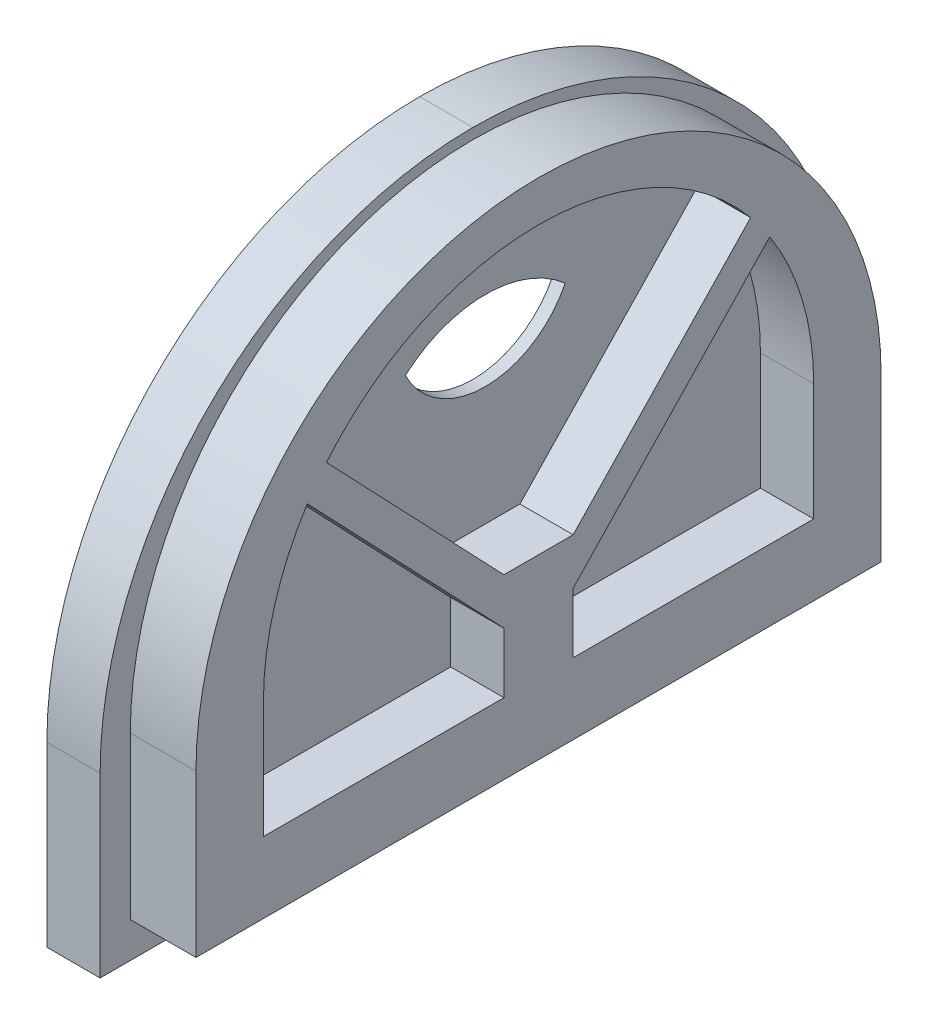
SolidWorks part; units mm, degrees
ref_plane "LAT. ESQUERDO" through (0, 0, 0) normal (0, 0, 1) x (1, 0, 0)
ref_plane "SUPERIOR" through (0, 0, 0) normal (0, 1, 0) x (1, 0, 0)
ref_plane "FRONTAL" through (0, 0, 0) normal (1, 0, 0) x (0, 0, -1)
sketch "Esboço1" plane through (0, 0, 0) normal (1, 0, 0) x (0, 0, -1)
  line L1 (-21, -15.5) -> (21, -15.5)
  line L2 (-21, -15.5) -> (-21, 15.5)
  line L3 (-21, 15.5) -> (21, 15.5)
  line L4 (21, -15.5) -> (21, 15.5)
  line L5 (-21, -15.5) -> (21, 15.5) construction
  line L6 (-21, 15.5) -> (21, -15.5) construction
  point P0 (0, 0)
  dimension "D1" = 42
  dimension "D2" = 31
extrude "Ressalto-extrusão1" add sketch "Esboço1" along normal blind 3
fillet "Filete1" radius 21 2 edges at (1.5, 15.5, -21) (1.5, 15.5, 21)
sketch "Esboço3" plane through (3, 0, 0) normal (1, 0, 0) x (0, 0, -1)
  line L0 (-19.3, -13.5) -> (19.3, -13.5)
  line L1 (-21, -15.5) -> (21, -15.5) construction
  line L2 (-21, -5.5) -> (-21, -15.5) construction
  line L3 (-19.3, -13.5) -> (-19.3, -4.4)
  line L4 (19.3, -4.4) -> (19.3, -13.5)
  line L5 (0, 14.9) -> (0, 15.5) construction
  arc A0 (-19.3, -4.4) -> (19.3, -4.4) centre (0, -4.4) cw
  point P2 (0, -13.5)
  dimension "D1" = 2
  dimension "D2" = 1.7
  dimension "D3" = 0.6
extrude "Ressalto-extrusão2" add sketch "Esboço3" along normal blind 3.7
sketch "Esboço4" plane through (6.7, 0, 0) normal (1, 0, 0) x (0, 0, -1)
  line L0 (-15.5, -9.5) -> (15.5, -9.5)
  line L1 (-19.3, -13.5) -> (19.3, -13.5) construction
  line L2 (-15.5, -9.5) -> (-15.5, -2.9)
  line L3 (15.5, -2.9) -> (15.5, -9.5)
  line L4 (0, 12.6) -> (0, 14.9) construction
  arc A0 (-15.5, -2.9) -> (15.5, -2.9) centre (0, -2.9) cw
  arc A1 (19.3, -4.4) -> (-19.3, -4.4) centre (0, -4.4) ccw construction
  point P2 (0, -9.5)
  dimension "D1" = 4
  dimension "D2" = 31
  dimension "D3" = 2.3
extrude "Corte-extrusão1" cut sketch "Esboço4" against normal blind 3
sketch "Esboço5" plane through (0, 0, 0) normal (-1, 0, 0) x (0, 0, 1)
  line L0 (-16, -10.5) -> (16, -10.5)
  line L1 (21, -15.5) -> (-21, -15.5) construction
  line L2 (-16, -10.5) -> (-16, -5.1)
  line L3 (16, -5.1) -> (16, -10.5)
  line L4 (0, 10.9) -> (0, 15.5) construction
  arc A0 (-16, -5.1) -> (16, -5.1) centre (0, -5.1) cw
  point P2 (0, -10.5)
  dimension "D1" = 5
  dimension "D2" = 32
  dimension "D3" = 4.6
extrude "Corte-extrusão2" cut sketch "Esboço5" against normal blind 3
sketch "Esboço6" plane through (3.7, 0, 0) normal (1, 0, 0) x (0, 0, -1)
  line L0 (-1.95, -9.5) -> (-1.95, -3.5)
  line L1 (-15.5, -9.5) -> (15.5, -9.5) construction
  line L2 (-1.95, -3.5) -> (1.95, -3.5)
  line L3 (1.95, -3.5) -> (1.95, -9.5)
  line L4 (1.95, -9.5) -> (-1.95, -9.5)
  line L5 (-19.3, -13.5) -> (19.3, -13.5) construction
  point P6 (0, -3.5)
  dimension "D1" = 3.9
  dimension "D2" = 10
extrude "Ressalto-extrusão3" add sketch "Esboço6" along normal blind 3
sketch "Esboço7" plane through (3.7, 0, 0) normal (1, 0, 0) x (0, 0, -1)
  line L0 (1.95, -6.1073) -> (13.0265, 5.5)
  line L1 (1.95, -9.5) -> (1.95, -3.5) construction
  line L2 (1.95, -3.5) -> (11.9466, 6.9756)
  line L3 (1.95, -9.5) -> (15.5, -9.5) construction
  line L4 (1.95, -6.1073) -> (1.95, -3.5)
  arc A0 (15.5, -2.9) -> (-15.5, -2.9) centre (0, -2.9) ccw construction
  arc A1 (13.0265, 5.5) -> (11.9466, 6.9756) centre (0, -2.9) ccw
  dimension "D1" = 1.8
  dimension "D2" = 15
extrude "Ressalto-extrusão4" add sketch "Esboço7" along normal blind 3
mirror "Espelhar1" about plane through (0, 0, 0) normal (0, 0, 1) of "Ressalto-extrusão4"
sketch "Esboço8" plane through (3, 0, 0) normal (-1, 0, 0) x (0, 0, 1)
  line L0 (-16, -10.5) -> (16, -10.5) construction
  line L1 (-1.9, -10.5) -> (1.9, -10.5)
  line L2 (-1.9, -10.5) -> (-1.9, -5.5)
  line L3 (-1.9, -5.5) -> (1.9, -5.5)
  line L4 (1.9, -10.5) -> (1.9, -5.5)
  line L5 (21, -15.5) -> (-21, -15.5) construction
  point P6 (0, -5.5)
  dimension "D1" = 10
  dimension "D2" = 3.8
extrude "Ressalto-extrusão5" add sketch "Esboço8" along normal blind 3
sketch "Esboço9" plane through (3, 0, 0) normal (-1, 0, 0) x (0, 0, 1)
  line L0 (1.9, -5.5) -> (11.1783, 6.3475)
  line L1 (1.9, -8.4194) -> (12.4093, 5)
  line L2 (1.9, -10.5) -> (1.9, -5.5) construction
  line L3 (1.9, -8.4194) -> (1.9, -5.5)
  line L4 (1.9, -10.5) -> (16, -10.5) construction
  arc A0 (16, -5.1) -> (-16, -5.1) centre (0, -5.1) ccw construction
  arc A1 (16, -5.1) -> (-16, -5.1) centre (0, -5.1) ccw construction
  arc A2 (12.4093, 5) -> (11.1783, 6.3475) centre (0, -5.1) ccw
  dimension "D1" = 1.8
  dimension "D2" = 15.5
extrude "Ressalto-extrusão6" add sketch "Esboço9" along normal blind 3
mirror "Espelhar2" about plane through (0, 0, 0) normal (0, 0, 1) of "Ressalto-extrusão6"
sketch "Esboço10" plane through (3.7, 0, 0) normal (1, 0, 0) x (0, 0, -1)
  line L0 (0, 3.2) -> (0, 7.7) construction
  line L1 (-21, -15.5) -> (21, -15.5) construction
  arc A0 (-4.5, 6) -> (4.5, 6) centre (0, 0.8941) cw
  arc A1 (-4.5, 6) -> (4.5, 6) centre (0, 8.2161) ccw
  dimension "D1" = 21.5
  dimension "D2" = 18.7
  dimension "D3" = 9
  dimension "D4" = 4.5
extrude "Corte-extrusão3" cut sketch "Esboço10" against normal through all
